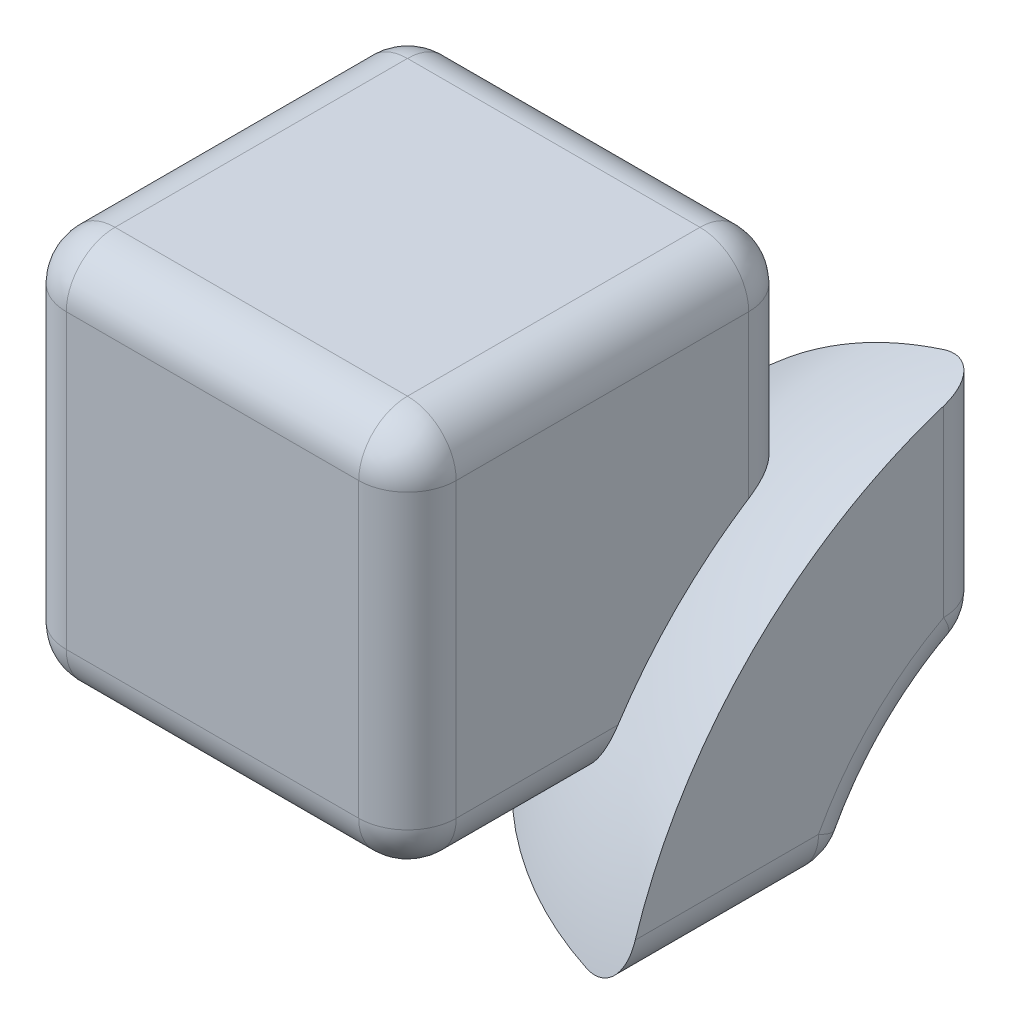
SolidWorks part; units mm, degrees
ref_plane "Front Plane" through (0, 0, 0) normal (0, 0, 1) x (1, 0, 0)
ref_plane "Top Plane" through (0, 0, 0) normal (0, 1, 0) x (1, 0, 0)
ref_plane "Right Plane" through (0, 0, 0) normal (1, 0, 0) x (0, 0, -1)
sketch "Sketch1" plane through (0, 0, 0) normal (0, 0, 1) x (1, 0, 0)
  line L1 (60, -60) -> (-60, -60)
  line L2 (60, -60) -> (60, 60)
  line L3 (60, 60) -> (-60, 60)
  line L4 (-60, -60) -> (-60, 60)
  line L5 (60, -60) -> (-60, 60) construction
  line L6 (60, 60) -> (-60, -60) construction
  point P0 (0, 0)
  dimension "D1" = 120
extrude "Boss-Extrude1" add sketch "Sketch1" along normal mid plane 120
sketch "Sketch2" plane through (0, 0, 0) normal (0, 0, 1) x (1, 0, 0)
  line L1 (50, -50) -> (-50, -50)
  line L2 (50, -50) -> (50, 50)
  line L3 (50, 50) -> (-50, 50)
  line L4 (-50, -50) -> (-50, 50)
  line L5 (50, -50) -> (-50, 50) construction
  line L6 (50, 50) -> (-50, -50) construction
  point P0 (0, 0)
  dimension "D1" = 100
extrude "Cut-Extrude1" cut sketch "Sketch2" against normal mid plane 100
sketch "Sketch3" plane through (0, 0, 0) normal (0, 0, 1) x (1, 0, 0)
  line L1 (0, 50) -> (0, 60)
  line L2 (0, -50) -> (0, -60)
  line L3 (60, 60) -> (-60, 60) construction
  line L4 (0, -50) -> (0, 50) construction
  arc A0 (0, 50) -> (0, -50) centre (0, 0) ccw
  arc A1 (0, 60) -> (0, -60) centre (0, 0) ccw
  point P6 (0, 0)
  dimension "D1" = 50
revolve "Revolve1" add sketch "Sketch3" angle 360 about L4
sketch "Sketch4" plane through (0, 0, 0) normal (0, 0, 1) x (1, 0, 0)
  line L0 (-20, 60) -> (-20, -60)
  line L1 (60, -60) -> (-60, -60)
  line L2 (60, -60) -> (60, 60)
  line L3 (60, 60) -> (-60, 60)
  line L4 (-60, -60) -> (-60, 60)
  line L5 (60, -60) -> (-60, 60) construction
  line L6 (60, 60) -> (-60, -60) construction
  line L8 (20, 60) -> (20, -60)
  line L10 (60, -20) -> (-60, -20)
  line L12 (60, 20) -> (-60, 20)
  point P0 (0, 0)
  dimension "D1" = 40
  dimension "D2" = 40
  dimension "D3" = 40
  dimension "D4" = 40
extrude "Cut-Extrude-Thin1" cut sketch "Sketch4" against normal through all both and the other way through all thin contours L12 L0 L3 L4
sketch "Sketch5" plane through (0, 0, 0) normal (0, 1, 0) x (1, 0, 0)
  line L0 (-20, 60) -> (-20, -60)
  line L1 (60, -60) -> (-60, -60)
  line L2 (60, -60) -> (60, 60)
  line L3 (60, 60) -> (-60, 60)
  line L4 (-60, -60) -> (-60, 60)
  line L5 (60, -60) -> (-60, 60) construction
  line L6 (60, 60) -> (-60, -60) construction
  line L8 (20, 60) -> (20, -60)
  line L10 (60, -20) -> (-60, -20)
  line L12 (60, 20) -> (-60, 20)
  point P0 (0, 0)
  dimension "D1" = 120
  dimension "D2" = 40
  dimension "D3" = 40
  dimension "D4" = 40
  dimension "D5" = 40
extrude "Cut-Extrude2" cut sketch "Sketch5" against normal through all both and the other way through all contours L0 L12 L4 L10 | L12 L0 L3 L4
sketch "Sketch7" plane through (0, 0, 0) normal (1, 0, 0) x (0, 0, -1)
  line L0 (0, 50) -> (0, -50) construction
  line L1 (0, 30) -> (0, 50)
  line L2 (0, -30) -> (0, -50)
  arc A3 (0, 50) -> (0, -50) centre (0, 0) ccw
  arc A4 (0, 30) -> (0, -30) centre (0, 0) ccw
  point P3 (0, 0)
  dimension "D2" = 50
  dimension "D1" = 30
revolve "Revolve2" add sketch "Sketch7" angle 360 about L0
sketch "Sketch8" plane through (0, 0, 0) normal (0, 1, 0) x (1, 0, 0)
  line L0 (-10, -48.9898) -> (-10, -10)
  line L1 (-48.9898, -10) -> (-10, -10)
  circle A0 centre (0, 0) radius 50 construction
  arc A1 (-10, -48.9898) -> (-48.9898, -10) centre (0, 0) ccw
  dimension "D1" = 10
extrude "Cut-Extrude3" cut sketch "Sketch8" against normal through all both and the other way through all
sketch "Sketch9" plane through (0, 0, 0) normal (0, 0, 1) x (1, 0, 0)
  line L0 (-10, 10) -> (-47.9583, 10)
  line L1 (-10, -47.9583) -> (-10, 47.9583) construction
  line L2 (-10, 10) -> (-10, -47.9583)
  arc A0 (-10, 47.9583) -> (-10, -47.9583) centre (0, 0) ccw construction
  arc A1 (-47.9583, 10) -> (-10, -47.9583) centre (0, 0) ccw
  dimension "D1" = 10
extrude "Cut-Extrude4" cut sketch "Sketch9" along normal through all
fillet "Fillet1" radius 5 12 edges at (-60, 20, 40) (-60, 40, 20) (-60, 60, 40) (-40, 60, 20) (-20, 60, 40) (-60, 40, 60) (-40, 60, 60) (-20, 40, 60) (-40, 20, 60) (-50.6155, 20, 20) (-20, 50.6155, 20) (-20, 20, 50.6155)
fillet "Fillet2" radius 5 6 edges at (-20, 20, 10) (-20, 10, 20) (-10, 20, 20) (-10, 10, 37.2079) (-37.2079, 10, 10) (-10, 37.2079, 10)
sketch "Sketch13" plane through (-20, 0, 0) normal (1, 0, 0) x (0, 0, -1)
  line L0 (-20, 55) -> (-20, 38.4057) construction
  line L1 (-20, 55) -> (-20, 38.4057)
  line L4 (-55, 55) -> (-55, 25)
  line L5 (-55, 25) -> (-38.4057, 25)
  line L6 (-25, 38.4057) -> (-25, 55)
  line L7 (-25, 55) -> (-55, 55)
  line L8 (-55, 55) -> (-55, 25)
  line L9 (-55, 25) -> (-38.4057, 25)
  line L10 (-25, 38.4057) -> (-25, 55)
  line L11 (-25, 55) -> (-55, 55)
  arc A1 (-25, 38.4057) -> (-38.4057, 25) centre (0, 0) ccw
  arc A2 (-25, 38.4057) -> (-38.4057, 25) centre (0, 0) ccw
  dimension "D1" = 0
revolve "Revolve3" add sketch "Sketch13" angle 90 about L1
scale "Scale1" scale about centroid uniform scaling yes scale factor 0.75
sketch "Sketch10" plane through (0, 0, 54.0014) normal (0, 0, 1) x (1, 0, 0)
  line L0 (-39.0014, 27.8785) -> (-39.0014, 50.3785) construction
  line L1 (-50.2514, 27.8785) -> (-27.7514, 27.8785) construction
  line L2 (-27.7514, 50.3785) -> (-50.2514, 50.3785) construction
  line L4 (-50.2514, 50.3785) -> (-50.2514, 27.8785) construction
  line L5 (-50.2514, 39.1285) -> (-27.7514, 39.1285) construction
  line L6 (-27.7514, 27.8785) -> (-27.7514, 50.3785) construction
sketch "Sketch11" plane through (-54.0014, 0, 0) normal (-1, 0, 0) x (0, 0, 1)
  line L0 (39.0014, 50.3785) -> (39.0014, 27.8785) construction
  line L1 (50.2514, 50.3785) -> (27.7514, 50.3785) construction
  line L2 (27.7514, 27.8785) -> (50.2514, 27.8785) construction
  line L4 (27.7514, 50.3785) -> (27.7514, 27.8785) construction
  line L5 (27.7514, 39.1285) -> (50.2514, 39.1285) construction
  line L6 (50.2514, 27.8785) -> (50.2514, 50.3785) construction
sketch "Sketch12" plane through (0, 54.1285, 0) normal (0, 1, 0) x (1, 0, 0)
  line L0 (-39.0014, -27.7514) -> (-39.0014, -50.2514) construction
  line L1 (-27.7514, -27.7514) -> (-50.2514, -27.7514) construction
  line L2 (-50.2514, -50.2514) -> (-27.7514, -50.2514) construction
  line L4 (-50.2514, -27.7514) -> (-50.2514, -50.2514) construction
  line L5 (-50.2514, -39.0014) -> (-27.7514, -39.0014) construction
  line L6 (-27.7514, -50.2514) -> (-27.7514, -27.7514) construction
